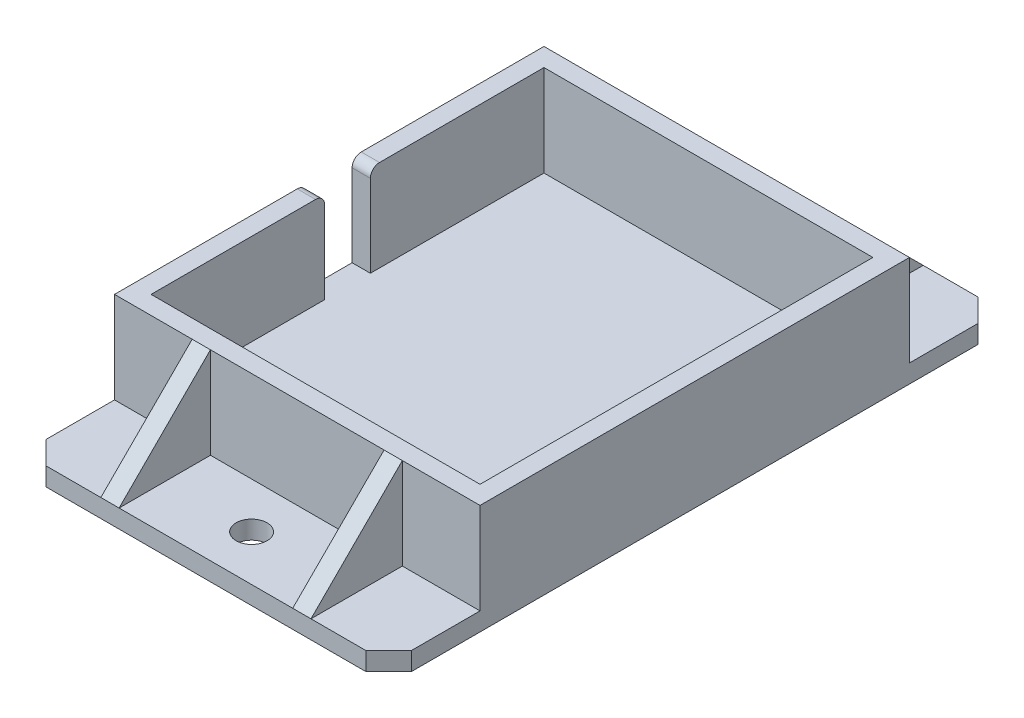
SolidWorks part; units mm, degrees
ref_plane "Front Plane" through (0, 0, 0) normal (0, 0, 1) x (1, 0, 0)
ref_plane "Top Plane" through (0, 0, 0) normal (0, 1, 0) x (1, 0, 0)
ref_plane "Right Plane" through (0, 0, 0) normal (1, 0, 0) x (0, 0, -1)
sketch "Sketch1" plane through (0, 0, 0) normal (0, 1, 0) x (1, 0, 0)
  line L5 (-40, 47) -> (40, 47)
  line L6 (-36, 43) -> (36, 43)
  line L10 (-36, 43) -> (-36, -43)
  line L11 (-36, -43) -> (36, -43)
  line L12 (36, 43) -> (36, -43)
  line L13 (-36, 43) -> (36, -43) construction
  line L14 (-36, -43) -> (36, 43) construction
  line L15 (40, 47) -> (40, -47)
  line L16 (-40, -47) -> (40, -47)
  line L17 (-40, 47) -> (-40, -47)
  point P0 (0, 0)
  dimension "D1" = 86
  dimension "D2" = 72
  dimension "D3" = 4
extrude "Boss-Extrude3" add sketch "Sketch1" along normal blind 20
sketch "Sketch10" plane through (0, 0, 0) normal (0, -1, 0) x (1, 0, 0)
  line L11 (-40, -47) -> (-40, 47) construction
  line L12 (0, 0) -> (-46.4736, 0) construction
  line L18 (-40, -67) -> (40, -67)
  line L19 (-40, -67) -> (-40, 67)
  line L20 (-40, 67) -> (40, 67)
  line L21 (40, -67) -> (40, 67)
  line L22 (-40, -67) -> (40, 67) construction
  line L23 (-40, 67) -> (40, -67) construction
  line L24 (-40, 47) -> (40, 47) construction
  point P0 (0, 0)
  point P11 (0, 57)
  point P16 (0, -57)
  dimension "D1" = 20
  dimension "D2" = 10
extrude "Boss-Extrude4" add sketch "Sketch10" along normal blind 4
sketch "Sketch11" plane through (-40, 0, 0) normal (-1, 0, 0) x (0, 0, 1)
  line L0 (0, 0) -> (0, 37.1567) construction
  line L1 (5, 20) -> (5, 0)
  line L2 (-47, 20) -> (47, 20) construction
  line L3 (5, 0) -> (-5, 0)
  line L4 (-5, 0) -> (-5, 20)
  line L5 (-5, 20) -> (5, 20)
  dimension "D1" = 5
  dimension "D2" = 10
extrude "Cut-Extrude1" cut sketch "Sketch11" against normal up to next
fillet "Fillet2" radius 2 2 edges at (-38, 20, -5) (-38, 20, 5)
sketch "Sketch24" plane through (0, 0, 0) normal (0, 1, 0) x (1, 0, 0)
  point P0 (0, 57)
  point P2 (0, -57)
hole_wizard "Tap Drill for M8 Tap2" positions "3DSketch4" profile "Sketch25" hole size "M8" standard "ISO"
sketch3d "3DSketch4"
  point P0 (0, 0, 57)
  point P3 (0, 0, -57)
sketch "Sketch25" plane through (0, 0, 57) normal (1, 0, 0) x (0, 0, 1)
  line L0 (0, 0) -> (0, 4)
  line L1 (0, 4) -> (3.4, 4)
  line L2 (3.4, 4) -> (3.4, 0)
  line L5 (3.4, 0) -> (0, 0)
  line L11 (0, -6.35) -> (0, 107.95) construction
  dimension "Thru Hole Dia." = 6.8
  dimension "Thru Hole Depth" = 4
ref_plane "Plane5" through (-21, 0, 0) normal (-1, 0, 0) x (0, 0, 1)
sketch "Sketch26" plane through (-21, 0, 0) normal (-1, 0, 0) x (0, 0, 1)
  line L0 (-67, 0) -> (-47, 20)
rib "Rib10" sketch "Sketch26" sketch "Sketch26" thickness 4 extrusion direction parallel to sketch draft on no parameters "D1"=4
mirror "Mirror3" about plane through (0, 0, 0) normal (1, 0, 0) of "Rib10"
mirror "Mirror4" about plane through (0, 0, 0) normal (0, 0, 1) of "Rib10", "Mirror3"
chamfer "Chamfer1" distance 5 angle 45 4 edges at (40, -2, 67) (-40, -2, 67) (40, -2, -67) (-40, -2, -67)
